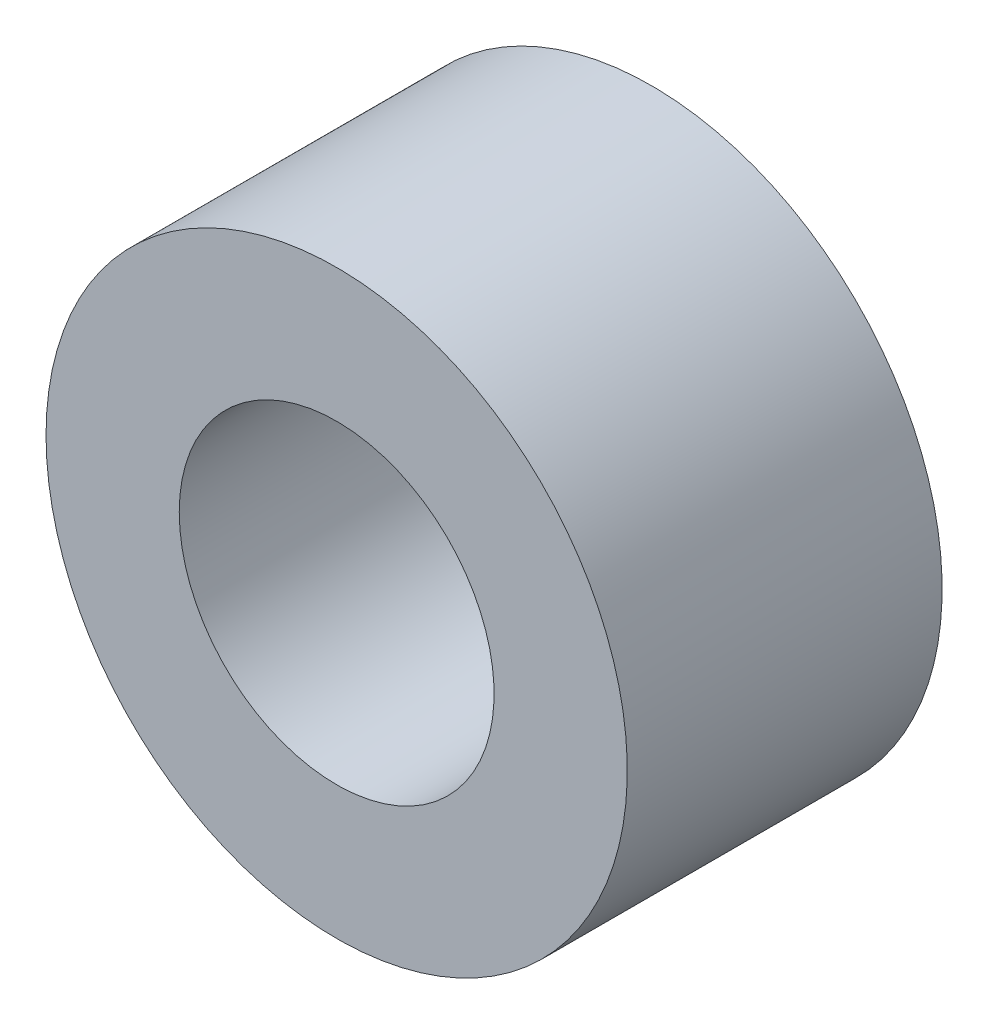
SolidWorks part; units mm, degrees
ref_plane "Frontal" through (0, 0, 0) normal (0, 0, 1) x (1, 0, 0)
ref_plane "Horizontal" through (0, 0, 0) normal (0, 1, 0) x (1, 0, 0)
ref_plane "Vertical" through (0, 0, 0) normal (1, 0, 0) x (0, 0, -1)
sketch "Esquisse1" plane through (0, 0, 0) normal (0, 0, 1) x (1, 0, 0)
  circle A0 centre (0, 0) radius 6
  circle A1 centre (0, 0) radius 3.25
  dimension "D1" = 12
  dimension "D2" = 6.5
extrude "Extrusion1" add sketch "Esquisse1" along normal blind 6.5
